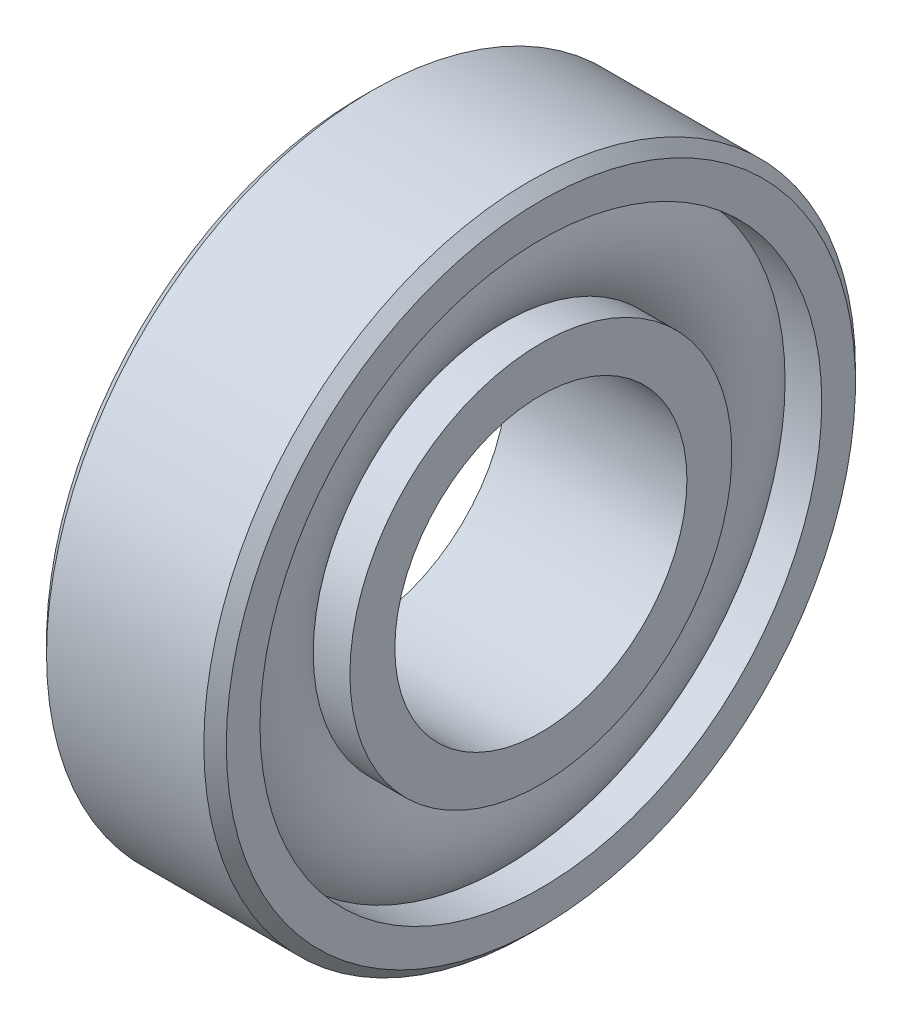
SolidWorks part; units mm, degrees
ref_plane "Face" through (0, 0, 0) normal (0, 0, 1) x (1, 0, 0)
ref_plane "Dessus" through (0, 0, 0) normal (0, 1, 0) x (1, 0, 0)
ref_plane "Droite" through (0, 0, 0) normal (1, 0, 0) x (0, 0, -1)
sketch "Esquisse1" plane through (0, 0, 0) normal (0, 0, 1) x (1, 0, 0)
  line L0 (0, 14.5) -> (0, -34.3123) construction
  line L1 (0, 0) -> (27.7138, 0) construction
  line L2 (0, 14.5) -> (8, 14.5)
  line L3 (0, 14.5) -> (0, 12.5)
  line L4 (0, 6.5) -> (8, 6.5)
  line L5 (8, 14.5) -> (8, 12.5)
  line L6 (-3.0733, 12.5) -> (9.9182, 12.5) construction
  line L7 (-3.0733, 8.5) -> (13.805, 8.5) construction
  line L8 (0, 8.5) -> (0, 6.5)
  line L9 (8, 8.5) -> (8, 6.5)
  line L10 (0, 14.5) -> (8, 6.5) construction
  line L11 (8, 14.5) -> (0, 6.5) construction
  line L12 (6.3685, 12.5) -> (8, 12.5)
  line L13 (6.3685, 8.5) -> (8, 8.5)
  line L14 (0, 12.5) -> (1.6315, 12.5)
  line L15 (0, 8.5) -> (1.6315, 8.5)
  arc A0 (1.6315, 12.5) -> (1.6315, 8.5) centre (4, 10.5) ccw
  arc A1 (6.3685, 8.5) -> (6.3685, 12.5) centre (4, 10.5) ccw
  dimension "D6" = 6.2
  dimension "D1" = 8
  dimension "D2" = 8
  dimension "D3" = 6.5
  dimension "D4" = 2
  dimension "D5" = 2
revolve "Base-Révolution" add sketch "Esquisse1" angle 360 about L1
chamfer "Chanfrein1" distance 0.5 angle 45
